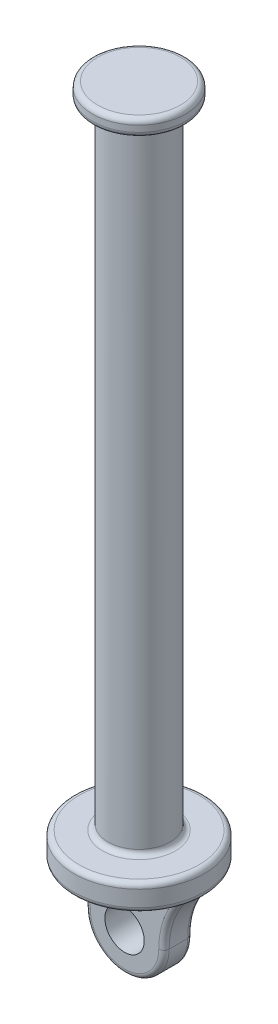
SolidWorks part; units mm, degrees
ref_plane "Front Plane" through (0, 0, 0) normal (0, 0, 1) x (1, 0, 0)
ref_plane "Top Plane" through (0, 0, 0) normal (0, 1, 0) x (1, 0, 0)
ref_plane "Right Plane" through (0, 0, 0) normal (1, 0, 0) x (0, 0, -1)
sketch "Sketch1" plane through (0, 0, 0) normal (0, 1, 0) x (1, 0, 0)
  circle A0 centre (0, 0) radius 15
  dimension "D1" = 30
extrude "Boss-Extrude1" add sketch "Sketch1" along normal blind 305
sketch "Sketch2" plane through (0, 305, 0) normal (0, 1, 0) x (1, 0, 0)
  circle A0 centre (0, 0) radius 22.5
  dimension "D1" = 45
extrude "Boss-Extrude2" add sketch "Sketch2" along normal blind 8
sketch "Sketch3" plane through (0, 0, 0) normal (0, -1, 0) x (1, 0, 0)
  circle A0 centre (0, 0) radius 31.5
  dimension "D1" = 63
extrude "Boss-Extrude3" add sketch "Sketch3" along normal blind 12.7
sketch "Sketch4" plane through (0, 0, 0) normal (0, 0, 1) x (1, 0, 0)
  line L0 (0, 0) -> (0, -78.2516) construction
  line L1 (-28.5, -12.7) -> (28.5, -12.7)
  arc A0 (-28.5, -12.7) -> (-18.9998, -38.0118) centre (-56.9994, -37.8353) cw
  arc A1 (28.5, -12.7) -> (18.9998, -38.0118) centre (56.9994, -37.8353) ccw
  arc A2 (-18.9998, -38.0118) -> (18.9998, -38.0118) centre (0, -38.1) ccw
  circle A3 centre (0, -38.1) radius 9.5
  dimension "D1" = 19
  dimension "D2" = 38
  dimension "D4" = 19
  dimension "D3" = 25.4
  dimension "D5" = 57
extrude "Boss-Extrude4" add sketch "Sketch4" along normal mid plane 13.97
fillet "Fillet1" radius 2.5 1 edges at (0, 0, -15)
fillet "Fillet5" radius 2.5 5 edges at (0, 305, 15) (0, 305, 22.5) (0, 313, 22.5) (0, 0, -31.5) (0, -12.7, -31.5)
fillet "Fillet6" radius 2.5 6 edges at (-21.429, -24.4656, -6.985) (0, -57.1, -6.985) (-21.429, -24.4656, 6.985) (0, -57.1, 6.985) (21.429, -24.4656, -6.985) (21.429, -24.4656, 6.985)
fillet "Fillet7" radius 2.5 8 edges at (28.5, -12.7, 0) (27.5144, -12.7, 6.2651) (0, -12.7, 6.985) (-28.0316, -12.7, 5.765) (-28.5, -12.7, 0) (-27.5144, -12.7, -6.2651) (0, -12.7, -6.985) (28.0316, -12.7, -5.765)
